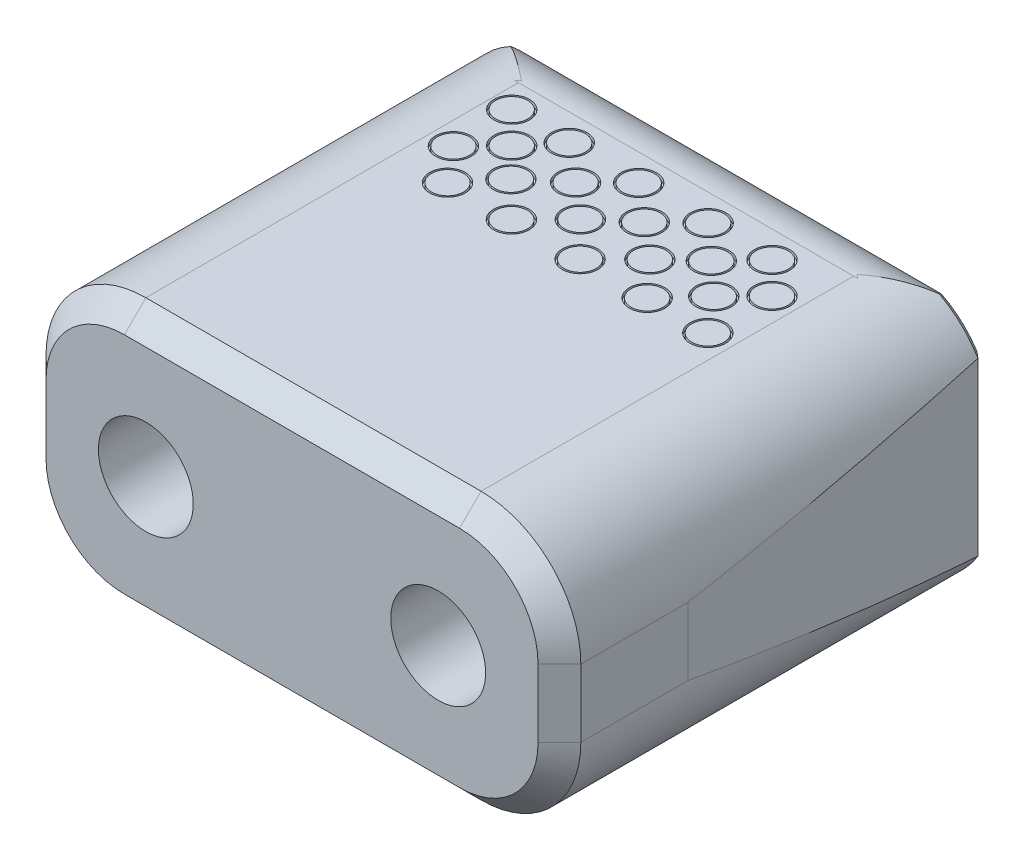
SolidWorks part; units mm, degrees
ref_plane "Front Plane" through (0, 0, 0) normal (0, 0, 1) x (1, 0, 0)
ref_plane "Top Plane" through (0, 0, 0) normal (0, 1, 0) x (1, 0, 0)
ref_plane "Right Plane" through (0, 0, 0) normal (1, 0, 0) x (0, 0, -1)
sketch "Sketch3" plane through (0, 0, 0) normal (1, 0, 0) x (0, 0, -1)
  line L1 (0, -9.525) -> (31.242, -9.525)
  line L2 (0, -9.525) -> (0, 9.525)
  line L3 (0, 9.525) -> (31.242, 9.525)
  line L4 (31.242, -9.525) -> (31.242, 9.525)
  line L6 (0, 0) -> (50000, 0) construction
  dimension "D1" = 31.242
  dimension "D3" = 19.05
extrude "Extrude1" add sketch "Sketch3" along normal blind 38.1
hole_wizard "1/4\"-20 CBORE" positions "Sketch7" profile "Sketch6" counterbore size "1/4" standard "ANSI Inch"
sketch "Sketch7" plane through (0, 0, -31.242) normal (0, 0, -1) x (-1, 0, 0)
  line L0 (0, 0) -> (50000, 0) construction
  line L1 (0, 10.4775) -> (0, -10.4775) construction
  line L3 (-38.1, -9.525) -> (-38.1, 9.525) construction
  point P0 (-8.636, 0)
  point P6 (-29.464, 0)
  dimension "D1" = 8.636
  dimension "D2" = 8.636
sketch "Sketch6" plane through (8.636, 0, -31.242) normal (1, 0, 0) x (0, 1, 0)
  line L0 (0, 0) -> (0, 31.242)
  line L1 (0, 31.242) -> (3.3782, 31.242)
  line L3 (3.3782, 31.242) -> (3.3782, 7.62)
  line L4 (3.3782, 7.62) -> (5.5562, 7.62)
  line L5 (5.5562, 7.62) -> (5.5562, 0)
  line L7 (5.5562, 0) -> (0, 0)
  line L11 (0, -6.35) -> (0, 107.95) construction
  dimension "Thru Hole Dia." = 6.7564
  dimension "Thru Hole Depth" = 31.242
  dimension "C'Bore Dia." = 11.1125
  dimension "C'Bore Depth" = 7.62
fillet "Fillet1" radius 7.112 4 edges at (38.1, -9.525, -15.621) (38.1, 9.525, -15.621) (0, 9.525, -15.621) (0, -9.525, -15.621)
chamfer "Chamfer1" distance 0.3969 angle 45 8 edges at (19.05, -9.525, -31.242) (36.0169, -7.4419, -31.242) (19.05, 9.525, -31.242) (38.1, 0, -31.242) (36.0169, 7.4419, -31.242) (0, 0, -31.242) (2.0831, 7.4419, -31.242) (2.0831, -7.4419, -31.242)
chamfer "Chamfer2" distance 1.524 angle 45 8 edges at (0, 0, 0) (19.05, -9.525, 0) (36.0169, -7.4419, 0) (38.1, 0, 0) (36.0169, 7.4419, 0) (19.05, 9.525, 0) (2.0831, -7.4419, 0) (2.0831, 7.4419, 0)
sketch "Sketch8" plane through (0, 0, 0) normal (-1, 0, 0) x (0, 0, 1)
  line L0 (0, 0) -> (-50000, 0) construction
  line L2 (-31.242, -8.3763) -> (-40.767, -8.3763)
  line L3 (-28.067, -9.5193) -> (-28.067, -22.2193)
  line L4 (-28.067, -22.2193) -> (-40.767, -22.2193)
  line L5 (-30.8451, 9.525) -> (-1.524, 9.525) construction
  line L6 (-31.242, -9.1281) -> (-31.242, 9.1281) construction
  line L7 (-40.767, -22.2193) -> (-40.767, -8.3763)
  line L10 (-40.767, 22.2193) -> (-40.767, 8.3763)
  line L11 (-28.067, 22.2193) -> (-40.767, 22.2193)
  line L12 (-28.067, 9.5193) -> (-28.067, 22.2193)
  line L13 (-31.242, 8.3763) -> (-40.767, 8.3763)
  arc A4 (-31.242, 8.3763) -> (-28.067, 9.5193) centre (-28.2894, 5.1559) cw
  arc A5 (-31.242, -8.3763) -> (-28.067, -9.5193) centre (-28.2894, -5.1559) ccw
  dimension "D1" = 3.175
  dimension "D2" = 1.143
  dimension "D4" = 12.7
  dimension "D5" = 12.7
extrude "Cut-Extrude2" cut sketch "Sketch8" against normal through all
ref_plane "Plane1" through (19.05, 0, 0) normal (1, 0, 0) x (0, 0, -1)
sketch "Sketch5" plane through (0, 0, 0) normal (0, 1, 0) x (1, 0, 0)
  line L1 (-5.497, 9.144) -> (49994.503, 9.144) construction
  line L3 (-10.4775, 0) -> (10.4775, 0) construction
  line L5 (38.1, 9.144) -> (50.8, 9.144)
  line L6 (50.8, 9.144) -> (50.8, 34.544)
  line L7 (50.8, 34.544) -> (36.6845, 34.544)
  line L8 (38.1, 30.8451) -> (38.1, 1.524) construction
  arc A1 (38.1, 9.144) -> (36.6845, 34.544) centre (-190.5, 9.144) ccw
  dimension "D2" = 228.6
  dimension "D1" = 9.144
  dimension "D3" = 12.7
  dimension "D4" = 25.4
extrude "Cut-Extrude1" cut sketch "Sketch5" against normal mid plane 25
mirror "Mirror4" about plane through (19.05, 0, 0) normal (1, 0, 0) of "Cut-Extrude1"
chamfer "Chamfer3" distance 0.3969 angle 45 1 edges at (37.0294, 0, -31.242)
sketch "Sketch9" plane through (0, 9.525, 0) normal (0, 1, 0) x (1, 0, 0)
  line L0 (0, 0) -> (50000, 0) construction
  circle A0 centre (12.6385, 26.156) radius 1.27
  circle A1 centre (12.6385, 26.156) radius 1.143
  circle A2 centre (17.5875, 26.156) radius 1.27
  circle A3 centre (17.5875, 26.156) radius 1.143
  circle A4 centre (22.5365, 26.156) radius 1.27
  circle A5 centre (22.5365, 26.156) radius 1.143
  circle A6 centre (27.0873, 26.156) radius 1.27
  circle A7 centre (27.0873, 26.156) radius 1.143
  circle A10 centre (15.3121, 23.9375) radius 1.27
  circle A11 centre (15.3121, 23.9375) radius 1.143
  circle A12 centre (20.2042, 23.9375) radius 1.27
  circle A13 centre (20.2042, 23.9375) radius 1.143
  circle A14 centre (24.9826, 23.9375) radius 1.27
  circle A15 centre (24.9826, 23.9375) radius 1.143
  circle A16 centre (29.3058, 23.9375) radius 1.27
  circle A17 centre (29.3058, 23.9375) radius 1.143
  circle A18 centre (12.8092, 21.8327) radius 1.27
  circle A19 centre (12.8092, 21.8327) radius 1.143
  circle A20 centre (10.7613, 23.9375) radius 1.27
  circle A21 centre (10.7613, 23.9375) radius 1.143
  circle A22 centre (17.7582, 21.8327) radius 1.27
  circle A23 centre (17.7582, 21.8327) radius 1.143
  circle A24 centre (22.7072, 21.8327) radius 1.27
  circle A25 centre (22.7072, 21.8327) radius 1.143
  circle A26 centre (8.5428, 26.156) radius 1.27
  circle A27 centre (8.5428, 26.156) radius 1.143
  circle A28 centre (27.258, 21.8327) radius 1.27
  circle A29 centre (27.258, 21.8327) radius 1.143
  circle A32 centre (8.7135, 21.8327) radius 1.27
  circle A33 centre (8.7135, 21.8327) radius 1.143
  circle A34 centre (15.3121, 19.3655) radius 1.27
  circle A35 centre (15.3121, 19.3655) radius 1.143
  circle A36 centre (20.2042, 19.3655) radius 1.27
  circle A37 centre (20.2042, 19.3655) radius 1.143
  circle A38 centre (24.9826, 19.3655) radius 1.27
  circle A39 centre (24.9826, 19.3655) radius 1.143
  circle A40 centre (29.3058, 19.3655) radius 1.27
  circle A41 centre (29.3058, 19.3655) radius 1.143
  circle A42 centre (10.7613, 19.3655) radius 1.27
  circle A43 centre (10.7613, 19.3655) radius 1.143
  dimension "D3" = 2.54
  dimension "D1" = 2
  dimension "D4" = 2.286
extrude "Cut-Extrude3" cut sketch "Sketch9" against normal blind 0.254
mirror "Mirror3" about plane through (0, 0, 0) normal (0, 1, 0) of "Cut-Extrude3"
